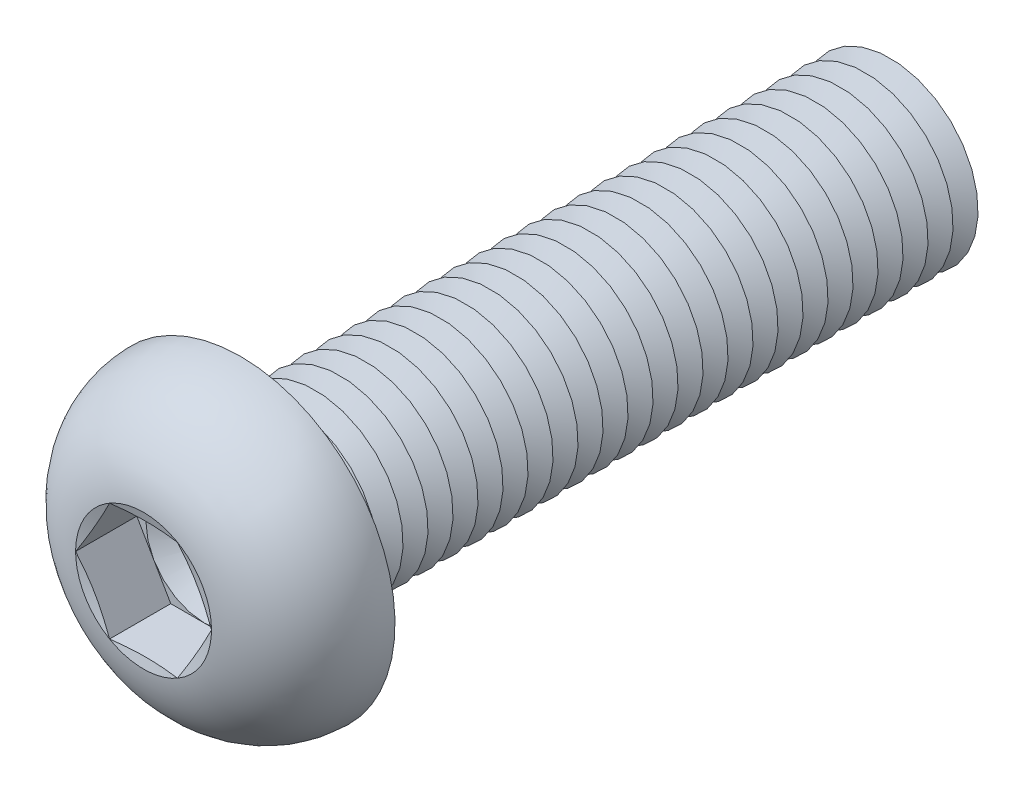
SolidWorks part; units mm, degrees
ref_plane "Front Plane" through (0, 0, 0) normal (0, 0, 1) x (1, 0, 0)
ref_plane "Top Plane" through (0, 0, 0) normal (0, 1, 0) x (1, 0, 0)
ref_plane "Right Plane" through (0, 0, 0) normal (1, 0, 0) x (0, 0, -1)
sketch "Sketch1" plane through (0, 0, 0) normal (1, 0, 0) x (0, 0, -1)
  line L0 (0, 6) -> (0, 10.5)
  line L3 (0, 6) -> (45, 6)
  line L4 (45, 6) -> (45, 0)
  line L5 (45, 0) -> (-6.6, 0) construction
  line L6 (-6.6, 0) -> (45, 0)
  line L7 (-6.6, 4.6188) -> (-6.6, 2.3094) construction
  line L8 (-6.6, 2.3094) -> (-6.6, 0)
  line L9 (-6.6, 4.6188) -> (-5.9812, 2.3094)
  line L10 (-5.9812, 2.3094) -> (-6.6, 2.3094)
  line L11 (45, 0) -> (22.7481, 0) construction
  line L12 (0, 10.5) -> (-6.6, 10.5) construction
  arc A1 (0, 10.5) -> (-6.6, 4.6188) centre (0, 3.8561) ccw
  point P8 (45, 3)
  dimension "D1" = 21
  dimension "D2" = 12
  dimension "D3" = 6.6
  dimension "D4" = 9.2376
  dimension "D5" = 45
  dimension "D6" = 15
revolve "Revolve1" add sketch "Sketch1" angle 360 about L5
fillet "Fillet1" radius 0.85 1 edges at (0, 6, 0)
sketch "Sketch2" plane through (0, 0, 0) normal (1, 0, 0) x (0, 0, -1)
  line L0 (44.15, 6) -> (45.85, 6)
  line L1 (45, 6) -> (0.85, 6) construction
  line L2 (45.85, 6) -> (45, 4.5278)
  line L3 (45, -6) -> (45, 6) construction
  line L4 (45, 4.5278) -> (44.15, 6)
  dimension "D1" = 1.7
revolve "Cut-Revolve1" cut sketch "Sketch2" angle 360 about axis through (0, 0, -45) along (0, 0, -1)
pattern_linear "LPattern1" count 26 spacing 1.7 along (0, 0, 1) of "Cut-Revolve1"
sketch "Sketch3" plane through (0, 0, 6.6) normal (0, 0, 1) x (1, 0, 0)
  line L7 (2.3094, 4) -> (-2.3094, 4)
  line L8 (-2.3094, 4) -> (-4.6188, 0)
  line L9 (-4.6188, 0) -> (-2.3094, -4)
  line L10 (-2.3094, -4) -> (2.3094, -4)
  line L11 (2.3094, -4) -> (4.6188, 0)
  line L12 (4.6188, 0) -> (2.3094, 4)
  circle A0 centre (0, 0) radius 4 construction
  circle A3 centre (0, 0) radius 4.6188 construction
extrude "Cut-Extrude1" cut sketch "Sketch3" against normal blind 4.16
sketch "Sketch4" plane through (0, 0, 2.44) normal (0, 0, 1) x (1, 0, 0)
  line L1 (2.3094, 4) -> (-2.3094, 4) construction
  circle A0 centre (0, 0) radius 4
extrude "Cut-Extrude2" cut sketch "Sketch4" against normal through all draft 60
